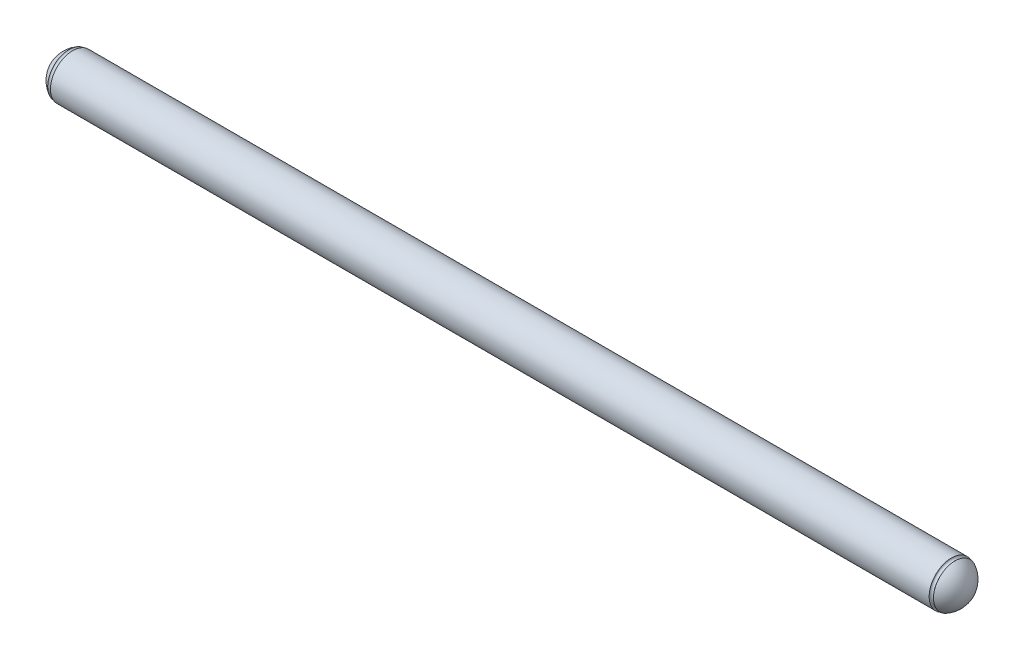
SolidWorks part; units mm, degrees
ref_plane "Спереди" through (0, 0, 0) normal (0, 0, 1) x (1, 0, 0)
ref_plane "Сверху" through (0, 0, 0) normal (0, 1, 0) x (1, 0, 0)
ref_plane "Справа" through (0, 0, 0) normal (1, 0, 0) x (0, 0, -1)
sketch "Эскиз1" plane through (0, 0, 0) normal (0, 0, 1) x (1, 0, 0)
  line L0 (-61.5, 0) -> (61.5, 0)
  line L1 (-59.25, 3) -> (59.25, 3)
  line L2 (-59.25, 4.7599) -> (-59.25, 2.3115) construction
  line L3 (0, 3) -> (0, 0) construction
  arc A0 (-59.7269, 2.895) -> (-61.5, 0) centre (-58.25, 0) ccw
  arc A1 (61.5, 0) -> (59.7269, 2.895) centre (58.25, 0) ccw
  arc A2 (-59.7269, 2.895) -> (-59.25, 3) centre (-59.5, 3) ccw
  arc A3 (59.7269, 2.895) -> (59.25, 3) centre (59.5, 3) cw
  dimension "D3" = 6.5
  dimension "D1" = 123
  dimension "D2" = 3
  dimension "D4" = 59.25
  dimension "D5" = 59.5
revolve "Повернуть1" add sketch "Эскиз1" angle 360 about L0
